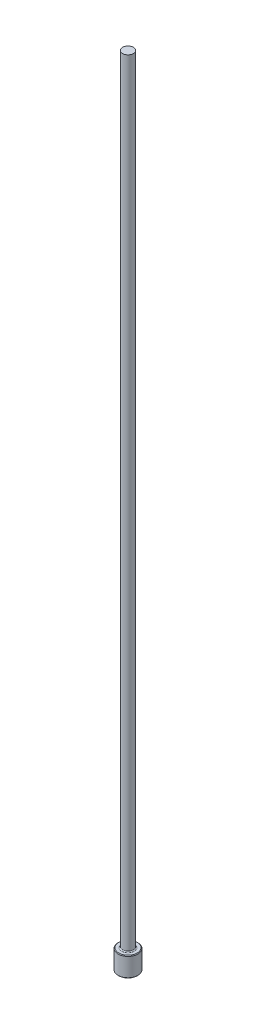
SolidWorks part; units mm, degrees
ref_plane "Front Plane" through (0, 0, 0) normal (0, 0, 1) x (1, 0, 0)
ref_plane "Top Plane" through (0, 0, 0) normal (0, 1, 0) x (1, 0, 0)
ref_plane "Right Plane" through (0, 0, 0) normal (1, 0, 0) x (0, 0, -1)
other "Configuration Table"
sketch "Sketch1" plane through (0, 0, 0) normal (0, 0, 1) x (1, 0, 0)
  line L0 (0, 259.9588) -> (0, -15.1925) construction
  line L1 (0, 0) -> (-0.7874, 0)
  line L2 (-0.7874, 0) -> (-0.7874, 1.5748)
  line L3 (-0.7874, 1.5748) -> (-0.4318, 1.5748)
  line L4 (-0.4318, 1.5748) -> (-0.4318, 63.5)
  line L5 (-0.4318, 63.5) -> (0, 63.5)
  line L6 (0, 63.5) -> (0, 0)
  dimension "L" = 63.5
  dimension "H" = 1.5748
  dimension "T" = 1.5748
  dimension "D" = 0.8636
revolve "Revolve1" add sketch "Sketch1" angle 360 about L0
chamfer "Chamfer1" distance 0.0508 angle 45 2 edges at (0, 1.5748, 0.7874) (0, 0, 0.7874)
fillet "Fillet1" radius 0.0762 1 edges at (0, 1.5748, 0.4318)
